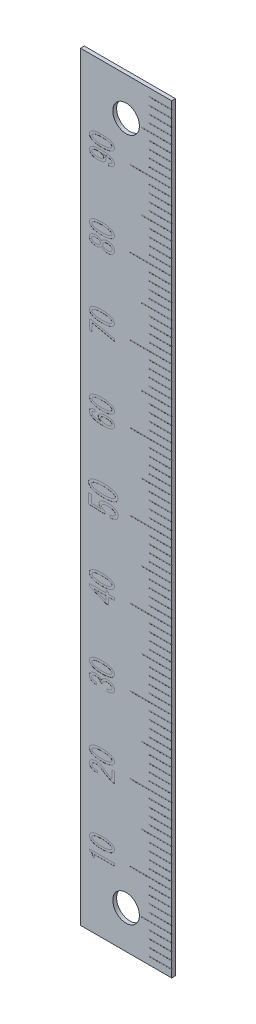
SolidWorks part; units mm, degrees
ref_plane "Front" through (0, 0, 0) normal (0, 0, 1) x (1, 0, 0)
ref_plane "Top" through (0, 0, 0) normal (0, 1, 0) x (1, 0, 0)
ref_plane "Right" through (0, 0, 0) normal (1, 0, 0) x (0, 0, -1)
sketch "Sketch1" plane through (0, 0, 0) normal (0, 0, 1) x (1, 0, 0)
  line L1 (0, 0) -> (0, 100)
  line L2 (0, 0) -> (12, 0)
  line L3 (12, 0) -> (12, 100)
  line L4 (0, 100) -> (12, 100)
  dimension "D1" = 100
  dimension "D2" = 12
extrude "Extrude1" add sketch "Sketch1" along normal blind 0.5
sketch "Sketch2" plane through (0, 0, 0.5) normal (0, 0, 1) x (1, 0, 0)
  line L0 (0, 100) -> (0, 0) construction
  line L1 (0, 0) -> (12, 0) construction
  line L2 (12, 100) -> (0, 100) construction
  circle A0 centre (6, 5) radius 1.75
  circle A1 centre (6, 95) radius 1.75
  dimension "D1" = 6
  dimension "D2" = 6
  dimension "D3" = 5
  dimension "D4" = 5
  dimension "D5" = 3.5
  dimension "D6" = 3.5
extrude "Extrude2" cut sketch "Sketch2" against normal through all
sketch "Sketch3" plane through (0, 0, 0.5) normal (0, 0, 1) x (1, 0, 0)
  line L0 (12, 100) -> (0, 100) construction
  line L1 (1, 88.25) -> (4.5, 88.25) construction
  line L2 (1, 88.25) -> (1, 91.75) construction
  line L3 (1, 91.75) -> (4.5, 91.75) construction
  line L4 (4.5, 88.25) -> (4.5, 91.75) construction
  line L5 (0, 100) -> (0, 0) construction
  line L6 (4.5, 78.25) -> (4.5, 81.75) construction
  line L7 (4.5, 68.25) -> (4.5, 71.75) construction
  line L8 (4.5, 58.25) -> (4.5, 61.75) construction
  line L9 (5, 48.25) -> (5, 51.75) construction
  line L10 (4.5, 38.25) -> (4.5, 41.75) construction
  line L11 (4.5, 28.25) -> (4.5, 31.75) construction
  line L12 (4.5, 18.25) -> (4.5, 21.75) construction
  line L13 (4.5, 8.25) -> (4.5, 11.75) construction
  line L14 (12, 0) -> (12, 100) construction
  text T0 "90" font "ＭＳ ゴシック" height in points 11
  text T1 "80  " font "ＭＳ ゴシック" height in points 11
  text T2 "70" font "ＭＳ ゴシック" height in points 11
  text T3 "60" font "ＭＳ ゴシック" height in points 11
  text T4 "50" font "ＭＳ ゴシック" height in points 13
  text T5 "40  " font "ＭＳ ゴシック" height in points 11
  text T6 "30" font "ＭＳ ゴシック" height in points 11
  text T7 "20" font "ＭＳ ゴシック" height in points 11
  text T8 "10" font "ＭＳ ゴシック" height in points 11
  point P4 (4.5, 90)
  dimension "D1" = 3.5
  dimension "D2" = 10
  dimension "D3" = 1
  dimension "D4" = 3.5
  dimension "D6" = 7
  dimension "D5" = 4
extrude "Extrude3" cut sketch "Sketch3" against normal blind 0.01
sketch "Sketch4" plane through (0, 0, 0.5) normal (0, 0, 1) x (1, 0, 0)
  line L0 (12, 90.05) -> (6.5, 90.05)
  line L1 (12, 0) -> (12, 100) construction
  line L2 (6.5, 90.05) -> (6.5, 89.95)
  line L3 (6.5, 89.95) -> (12, 89.95)
  line L4 (12, 89.95) -> (12, 90.05)
  line L5 (12, 100) -> (0, 100) construction
  line L6 (12, 98.05) -> (12, 97.95)
  line L7 (12, 94.95) -> (8, 94.95)
  line L8 (12, 94.95) -> (12, 95.05)
  line L9 (12, 95.05) -> (8, 95.05)
  line L10 (8, 94.95) -> (8, 95.05)
  line L11 (12, 99.05) -> (9, 99.05)
  line L12 (12, 99.05) -> (12, 98.95)
  line L13 (12, 98.95) -> (9, 98.95)
  line L14 (9, 99.05) -> (9, 98.95)
  line L15 (12, 98.05) -> (9, 98.05)
  line L16 (12, 97.95) -> (9, 97.95)
  line L17 (9, 98.05) -> (9, 97.95)
  line L18 (12, 97.05) -> (12, 96.95)
  line L19 (12, 97.05) -> (9, 97.05)
  line L20 (12, 96.95) -> (9, 96.95)
  line L21 (9, 97.05) -> (9, 96.95)
  line L22 (12, 96.05) -> (12, 95.95)
  line L23 (12, 96.05) -> (9, 96.05)
  line L24 (12, 95.95) -> (9, 95.95)
  line L25 (9, 96.05) -> (9, 95.95)
  line L26 (12, 80.05) -> (6.5, 80.05)
  line L27 (6.5, 80.05) -> (6.5, 79.95)
  line L28 (6.5, 79.95) -> (12, 79.95)
  line L29 (12, 79.95) -> (12, 80.05)
  line L30 (12, 94.05) -> (12, 93.95)
  line L31 (12, 94.05) -> (9, 94.05)
  line L32 (12, 93.95) -> (9, 93.95)
  line L33 (9, 94.05) -> (9, 93.95)
  line L34 (12, 93.05) -> (12, 92.95)
  line L35 (12, 93.05) -> (9, 93.05)
  line L36 (12, 92.95) -> (9, 92.95)
  line L37 (9, 93.05) -> (9, 92.95)
  line L38 (12, 92.05) -> (12, 91.95)
  line L39 (12, 92.05) -> (9, 92.05)
  line L40 (12, 91.95) -> (9, 91.95)
  line L41 (9, 92.05) -> (9, 91.95)
  line L42 (12, 91.05) -> (12, 90.95)
  line L43 (12, 91.05) -> (9, 91.05)
  line L44 (12, 90.95) -> (9, 90.95)
  line L45 (9, 91.05) -> (9, 90.95)
  line L46 (9, 95.05) -> (9, 94.95)
  line L47 (12, 95.05) -> (9, 95.05)
  line L48 (12, 94.95) -> (9, 94.95)
  line L49 (12, 95.05) -> (12, 94.95)
  line L50 (12, 88.05) -> (12, 87.95)
  line L51 (12, 84.95) -> (8, 84.95)
  line L52 (12, 84.95) -> (12, 85.05)
  line L53 (12, 85.05) -> (8, 85.05)
  line L54 (8, 84.95) -> (8, 85.05)
  line L55 (12, 89.05) -> (9, 89.05)
  line L56 (12, 89.05) -> (12, 88.95)
  line L57 (12, 88.95) -> (9, 88.95)
  line L58 (9, 89.05) -> (9, 88.95)
  line L59 (12, 88.05) -> (9, 88.05)
  line L60 (12, 87.95) -> (9, 87.95)
  line L61 (9, 88.05) -> (9, 87.95)
  line L62 (12, 87.05) -> (12, 86.95)
  line L63 (12, 87.05) -> (9, 87.05)
  line L64 (12, 86.95) -> (9, 86.95)
  line L65 (9, 87.05) -> (9, 86.95)
  line L66 (12, 86.05) -> (12, 85.95)
  line L67 (12, 86.05) -> (9, 86.05)
  line L68 (12, 85.95) -> (9, 85.95)
  line L69 (9, 86.05) -> (9, 85.95)
  line L70 (12, 84.05) -> (12, 83.95)
  line L71 (12, 84.05) -> (9, 84.05)
  line L72 (12, 83.95) -> (9, 83.95)
  line L73 (9, 84.05) -> (9, 83.95)
  line L74 (12, 83.05) -> (12, 82.95)
  line L75 (12, 83.05) -> (9, 83.05)
  line L76 (12, 82.95) -> (9, 82.95)
  line L77 (9, 83.05) -> (9, 82.95)
  line L78 (12, 82.05) -> (12, 81.95)
  line L79 (12, 82.05) -> (9, 82.05)
  line L80 (12, 81.95) -> (9, 81.95)
  line L81 (9, 82.05) -> (9, 81.95)
  line L82 (12, 81.05) -> (12, 80.95)
  line L83 (12, 81.05) -> (9, 81.05)
  line L84 (12, 80.95) -> (9, 80.95)
  line L85 (9, 81.05) -> (9, 80.95)
  line L86 (12, 70.05) -> (6.5, 70.05)
  line L87 (6.5, 70.05) -> (6.5, 69.95)
  line L88 (6.5, 69.95) -> (12, 69.95)
  line L89 (12, 69.95) -> (12, 70.05)
  line L90 (12, 78.05) -> (12, 77.95)
  line L91 (12, 74.95) -> (8, 74.95)
  line L92 (12, 74.95) -> (12, 75.05)
  line L93 (12, 75.05) -> (8, 75.05)
  line L94 (8, 74.95) -> (8, 75.05)
  line L95 (12, 79.05) -> (9, 79.05)
  line L96 (12, 79.05) -> (12, 78.95)
  line L97 (12, 78.95) -> (9, 78.95)
  line L98 (9, 79.05) -> (9, 78.95)
  line L99 (12, 78.05) -> (9, 78.05)
  line L100 (12, 77.95) -> (9, 77.95)
  line L101 (9, 78.05) -> (9, 77.95)
  line L102 (12, 77.05) -> (12, 76.95)
  line L103 (12, 77.05) -> (9, 77.05)
  line L104 (12, 76.95) -> (9, 76.95)
  line L105 (9, 77.05) -> (9, 76.95)
  line L106 (12, 76.05) -> (12, 75.95)
  line L107 (12, 76.05) -> (9, 76.05)
  line L108 (12, 75.95) -> (9, 75.95)
  line L109 (9, 76.05) -> (9, 75.95)
  line L110 (12, 74.05) -> (12, 73.95)
  line L111 (12, 74.05) -> (9, 74.05)
  line L112 (12, 73.95) -> (9, 73.95)
  line L113 (9, 74.05) -> (9, 73.95)
  line L114 (12, 73.05) -> (12, 72.95)
  line L115 (12, 73.05) -> (9, 73.05)
  line L116 (12, 72.95) -> (9, 72.95)
  line L117 (9, 73.05) -> (9, 72.95)
  line L118 (12, 72.05) -> (12, 71.95)
  line L119 (12, 72.05) -> (9, 72.05)
  line L120 (12, 71.95) -> (9, 71.95)
  line L121 (9, 72.05) -> (9, 71.95)
  line L122 (12, 71.05) -> (12, 70.95)
  line L123 (12, 71.05) -> (9, 71.05)
  line L124 (12, 70.95) -> (9, 70.95)
  line L125 (9, 71.05) -> (9, 70.95)
  line L126 (12, 60.05) -> (6.5, 60.05)
  line L127 (6.5, 60.05) -> (6.5, 59.95)
  line L128 (6.5, 59.95) -> (12, 59.95)
  line L129 (12, 59.95) -> (12, 60.05)
  line L130 (12, 68.05) -> (12, 67.95)
  line L131 (12, 64.95) -> (8, 64.95)
  line L132 (12, 64.95) -> (12, 65.05)
  line L133 (12, 65.05) -> (8, 65.05)
  line L134 (8, 64.95) -> (8, 65.05)
  line L135 (12, 69.05) -> (9, 69.05)
  line L136 (12, 69.05) -> (12, 68.95)
  line L137 (12, 68.95) -> (9, 68.95)
  line L138 (9, 69.05) -> (9, 68.95)
  line L139 (12, 68.05) -> (9, 68.05)
  line L140 (12, 67.95) -> (9, 67.95)
  line L141 (9, 68.05) -> (9, 67.95)
  line L142 (12, 67.05) -> (12, 66.95)
  line L143 (12, 67.05) -> (9, 67.05)
  line L144 (12, 66.95) -> (9, 66.95)
  line L145 (9, 67.05) -> (9, 66.95)
  line L146 (12, 66.05) -> (12, 65.95)
  line L147 (12, 66.05) -> (9, 66.05)
  line L148 (12, 65.95) -> (9, 65.95)
  line L149 (9, 66.05) -> (9, 65.95)
  line L150 (12, 64.05) -> (12, 63.95)
  line L151 (12, 64.05) -> (9, 64.05)
  line L152 (12, 63.95) -> (9, 63.95)
  line L153 (9, 64.05) -> (9, 63.95)
  line L154 (12, 63.05) -> (12, 62.95)
  line L155 (12, 63.05) -> (9, 63.05)
  line L156 (12, 62.95) -> (9, 62.95)
  line L157 (9, 63.05) -> (9, 62.95)
  line L158 (12, 62.05) -> (12, 61.95)
  line L159 (12, 62.05) -> (9, 62.05)
  line L160 (12, 61.95) -> (9, 61.95)
  line L161 (9, 62.05) -> (9, 61.95)
  line L162 (12, 61.05) -> (12, 60.95)
  line L163 (12, 61.05) -> (9, 61.05)
  line L164 (12, 60.95) -> (9, 60.95)
  line L165 (9, 61.05) -> (9, 60.95)
  line L166 (12, 50.05) -> (6.5, 50.05)
  line L167 (6.5, 50.05) -> (6.5, 49.95)
  line L168 (6.5, 49.95) -> (12, 49.95)
  line L169 (12, 49.95) -> (12, 50.05)
  line L170 (12, 58.05) -> (12, 57.95)
  line L171 (12, 54.95) -> (8, 54.95)
  line L172 (12, 54.95) -> (12, 55.05)
  line L173 (12, 55.05) -> (8, 55.05)
  line L174 (8, 54.95) -> (8, 55.05)
  line L175 (12, 59.05) -> (9, 59.05)
  line L176 (12, 59.05) -> (12, 58.95)
  line L177 (12, 58.95) -> (9, 58.95)
  line L178 (9, 59.05) -> (9, 58.95)
  line L179 (12, 58.05) -> (9, 58.05)
  line L180 (12, 57.95) -> (9, 57.95)
  line L181 (9, 58.05) -> (9, 57.95)
  line L182 (12, 57.05) -> (12, 56.95)
  line L183 (12, 57.05) -> (9, 57.05)
  line L184 (12, 56.95) -> (9, 56.95)
  line L185 (9, 57.05) -> (9, 56.95)
  line L186 (12, 56.05) -> (12, 55.95)
  line L187 (12, 56.05) -> (9, 56.05)
  line L188 (12, 55.95) -> (9, 55.95)
  line L189 (9, 56.05) -> (9, 55.95)
  line L190 (12, 54.05) -> (12, 53.95)
  line L191 (12, 54.05) -> (9, 54.05)
  line L192 (12, 53.95) -> (9, 53.95)
  line L193 (9, 54.05) -> (9, 53.95)
  line L194 (12, 53.05) -> (12, 52.95)
  line L195 (12, 53.05) -> (9, 53.05)
  line L196 (12, 52.95) -> (9, 52.95)
  line L197 (9, 53.05) -> (9, 52.95)
  line L198 (12, 52.05) -> (12, 51.95)
  line L199 (12, 52.05) -> (9, 52.05)
  line L200 (12, 51.95) -> (9, 51.95)
  line L201 (9, 52.05) -> (9, 51.95)
  line L202 (12, 51.05) -> (12, 50.95)
  line L203 (12, 51.05) -> (9, 51.05)
  line L204 (12, 50.95) -> (9, 50.95)
  line L205 (9, 51.05) -> (9, 50.95)
  line L206 (12, 50.05) -> (6.5, 50.05)
  line L207 (6.5, 50.05) -> (6.5, 49.95)
  line L208 (6.5, 49.95) -> (12, 49.95)
  line L209 (12, 49.95) -> (12, 50.05)
  line L210 (12, 48.05) -> (12, 47.95)
  line L211 (12, 44.95) -> (8, 44.95)
  line L212 (12, 44.95) -> (12, 45.05)
  line L213 (12, 45.05) -> (8, 45.05)
  line L214 (8, 44.95) -> (8, 45.05)
  line L215 (12, 49.05) -> (9, 49.05)
  line L216 (12, 49.05) -> (12, 48.95)
  line L217 (12, 48.95) -> (9, 48.95)
  line L218 (9, 49.05) -> (9, 48.95)
  line L219 (12, 48.05) -> (9, 48.05)
  line L220 (12, 47.95) -> (9, 47.95)
  line L221 (9, 48.05) -> (9, 47.95)
  line L222 (12, 47.05) -> (12, 46.95)
  line L223 (12, 47.05) -> (9, 47.05)
  line L224 (12, 46.95) -> (9, 46.95)
  line L225 (9, 47.05) -> (9, 46.95)
  line L226 (12, 46.05) -> (12, 45.95)
  line L227 (12, 46.05) -> (9, 46.05)
  line L228 (12, 45.95) -> (9, 45.95)
  line L229 (9, 46.05) -> (9, 45.95)
  line L230 (12, 44.05) -> (12, 43.95)
  line L231 (12, 44.05) -> (9, 44.05)
  line L232 (12, 43.95) -> (9, 43.95)
  line L233 (9, 44.05) -> (9, 43.95)
  line L234 (12, 43.05) -> (12, 42.95)
  line L235 (12, 43.05) -> (9, 43.05)
  line L236 (12, 42.95) -> (9, 42.95)
  line L237 (9, 43.05) -> (9, 42.95)
  line L238 (12, 42.05) -> (12, 41.95)
  line L239 (12, 42.05) -> (9, 42.05)
  line L240 (12, 41.95) -> (9, 41.95)
  line L241 (9, 42.05) -> (9, 41.95)
  line L242 (12, 41.05) -> (12, 40.95)
  line L243 (12, 41.05) -> (9, 41.05)
  line L244 (12, 40.95) -> (9, 40.95)
  line L245 (9, 41.05) -> (9, 40.95)
  line L246 (12, 40.05) -> (6.5, 40.05)
  line L247 (6.5, 40.05) -> (6.5, 39.95)
  line L248 (6.5, 39.95) -> (12, 39.95)
  line L249 (12, 39.95) -> (12, 40.05)
  line L250 (12, 38.05) -> (12, 37.95)
  line L251 (12, 34.95) -> (8, 34.95)
  line L252 (12, 34.95) -> (12, 35.05)
  line L253 (12, 35.05) -> (8, 35.05)
  line L254 (8, 34.95) -> (8, 35.05)
  line L255 (12, 39.05) -> (9, 39.05)
  line L256 (12, 39.05) -> (12, 38.95)
  line L257 (12, 38.95) -> (9, 38.95)
  line L258 (9, 39.05) -> (9, 38.95)
  line L259 (12, 38.05) -> (9, 38.05)
  line L260 (12, 37.95) -> (9, 37.95)
  line L261 (9, 38.05) -> (9, 37.95)
  line L262 (12, 37.05) -> (12, 36.95)
  line L263 (12, 37.05) -> (9, 37.05)
  line L264 (12, 36.95) -> (9, 36.95)
  line L265 (9, 37.05) -> (9, 36.95)
  line L266 (12, 36.05) -> (12, 35.95)
  line L267 (12, 36.05) -> (9, 36.05)
  line L268 (12, 35.95) -> (9, 35.95)
  line L269 (9, 36.05) -> (9, 35.95)
  line L270 (12, 34.05) -> (12, 33.95)
  line L271 (12, 34.05) -> (9, 34.05)
  line L272 (12, 33.95) -> (9, 33.95)
  line L273 (9, 34.05) -> (9, 33.95)
  line L274 (12, 33.05) -> (12, 32.95)
  line L275 (12, 33.05) -> (9, 33.05)
  line L276 (12, 32.95) -> (9, 32.95)
  line L277 (9, 33.05) -> (9, 32.95)
  line L278 (12, 32.05) -> (12, 31.95)
  line L279 (12, 32.05) -> (9, 32.05)
  line L280 (12, 31.95) -> (9, 31.95)
  line L281 (9, 32.05) -> (9, 31.95)
  line L282 (12, 31.05) -> (12, 30.95)
  line L283 (12, 31.05) -> (9, 31.05)
  line L284 (12, 30.95) -> (9, 30.95)
  line L285 (9, 31.05) -> (9, 30.95)
  line L286 (12, 30.05) -> (6.5, 30.05)
  line L287 (6.5, 30.05) -> (6.5, 29.95)
  line L288 (6.5, 29.95) -> (12, 29.95)
  line L289 (12, 29.95) -> (12, 30.05)
  line L290 (12, 28.05) -> (12, 27.95)
  line L291 (12, 24.95) -> (8, 24.95)
  line L292 (12, 24.95) -> (12, 25.05)
  line L293 (12, 25.05) -> (8, 25.05)
  line L294 (8, 24.95) -> (8, 25.05)
  line L295 (12, 29.05) -> (9, 29.05)
  line L296 (12, 29.05) -> (12, 28.95)
  line L297 (12, 28.95) -> (9, 28.95)
  line L298 (9, 29.05) -> (9, 28.95)
  line L299 (12, 28.05) -> (9, 28.05)
  line L300 (12, 27.95) -> (9, 27.95)
  line L301 (9, 28.05) -> (9, 27.95)
  line L302 (12, 27.05) -> (12, 26.95)
  line L303 (12, 27.05) -> (9, 27.05)
  line L304 (12, 26.95) -> (9, 26.95)
  line L305 (9, 27.05) -> (9, 26.95)
  line L306 (12, 26.05) -> (12, 25.95)
  line L307 (12, 26.05) -> (9, 26.05)
  line L308 (12, 25.95) -> (9, 25.95)
  line L309 (9, 26.05) -> (9, 25.95)
  line L310 (12, 24.05) -> (12, 23.95)
  line L311 (12, 24.05) -> (9, 24.05)
  line L312 (12, 23.95) -> (9, 23.95)
  line L313 (9, 24.05) -> (9, 23.95)
  line L314 (12, 23.05) -> (12, 22.95)
  line L315 (12, 23.05) -> (9, 23.05)
  line L316 (12, 22.95) -> (9, 22.95)
  line L317 (9, 23.05) -> (9, 22.95)
  line L318 (12, 22.05) -> (12, 21.95)
  line L319 (12, 22.05) -> (9, 22.05)
  line L320 (12, 21.95) -> (9, 21.95)
  line L321 (9, 22.05) -> (9, 21.95)
  line L322 (12, 21.05) -> (12, 20.95)
  line L323 (12, 21.05) -> (9, 21.05)
  line L324 (12, 20.95) -> (9, 20.95)
  line L325 (9, 21.05) -> (9, 20.95)
  line L326 (12, 20.05) -> (6.5, 20.05)
  line L327 (6.5, 20.05) -> (6.5, 19.95)
  line L328 (6.5, 19.95) -> (12, 19.95)
  line L329 (12, 19.95) -> (12, 20.05)
  line L330 (12, 18.05) -> (12, 17.95)
  line L331 (12, 14.95) -> (8, 14.95)
  line L332 (12, 14.95) -> (12, 15.05)
  line L333 (12, 15.05) -> (8, 15.05)
  line L334 (8, 14.95) -> (8, 15.05)
  line L335 (12, 19.05) -> (9, 19.05)
  line L336 (12, 19.05) -> (12, 18.95)
  line L337 (12, 18.95) -> (9, 18.95)
  line L338 (9, 19.05) -> (9, 18.95)
  line L339 (12, 18.05) -> (9, 18.05)
  line L340 (12, 17.95) -> (9, 17.95)
  line L341 (9, 18.05) -> (9, 17.95)
  line L342 (12, 17.05) -> (12, 16.95)
  line L343 (12, 17.05) -> (9, 17.05)
  line L344 (12, 16.95) -> (9, 16.95)
  line L345 (9, 17.05) -> (9, 16.95)
  line L346 (12, 16.05) -> (12, 15.95)
  line L347 (12, 16.05) -> (9, 16.05)
  line L348 (12, 15.95) -> (9, 15.95)
  line L349 (9, 16.05) -> (9, 15.95)
  line L350 (12, 14.05) -> (12, 13.95)
  line L351 (12, 14.05) -> (9, 14.05)
  line L352 (12, 13.95) -> (9, 13.95)
  line L353 (9, 14.05) -> (9, 13.95)
  line L354 (12, 13.05) -> (12, 12.95)
  line L355 (12, 13.05) -> (9, 13.05)
  line L356 (12, 12.95) -> (9, 12.95)
  line L357 (9, 13.05) -> (9, 12.95)
  line L358 (12, 12.05) -> (12, 11.95)
  line L359 (12, 12.05) -> (9, 12.05)
  line L360 (12, 11.95) -> (9, 11.95)
  line L361 (9, 12.05) -> (9, 11.95)
  line L362 (12, 11.05) -> (12, 10.95)
  line L363 (12, 11.05) -> (9, 11.05)
  line L364 (12, 10.95) -> (9, 10.95)
  line L365 (9, 11.05) -> (9, 10.95)
  line L366 (12, 10.05) -> (6.5, 10.05)
  line L367 (6.5, 10.05) -> (6.5, 9.95)
  line L368 (6.5, 9.95) -> (12, 9.95)
  line L369 (12, 9.95) -> (12, 10.05)
  line L370 (12, 8.05) -> (12, 7.95)
  line L371 (12, 4.95) -> (8, 4.95)
  line L372 (12, 4.95) -> (12, 5.05)
  line L373 (12, 5.05) -> (8, 5.05)
  line L374 (8, 4.95) -> (8, 5.05)
  line L375 (12, 9.05) -> (9, 9.05)
  line L376 (12, 9.05) -> (12, 8.95)
  line L377 (12, 8.95) -> (9, 8.95)
  line L378 (9, 9.05) -> (9, 8.95)
  line L379 (12, 8.05) -> (9, 8.05)
  line L380 (12, 7.95) -> (9, 7.95)
  line L381 (9, 8.05) -> (9, 7.95)
  line L382 (12, 7.05) -> (12, 6.95)
  line L383 (12, 7.05) -> (9, 7.05)
  line L384 (12, 6.95) -> (9, 6.95)
  line L385 (9, 7.05) -> (9, 6.95)
  line L386 (12, 6.05) -> (12, 5.95)
  line L387 (12, 6.05) -> (9, 6.05)
  line L388 (12, 5.95) -> (9, 5.95)
  line L389 (9, 6.05) -> (9, 5.95)
  line L390 (12, 4.05) -> (12, 3.95)
  line L391 (12, 4.05) -> (9, 4.05)
  line L392 (12, 3.95) -> (9, 3.95)
  line L393 (9, 4.05) -> (9, 3.95)
  line L394 (12, 3.05) -> (12, 2.95)
  line L395 (12, 3.05) -> (9, 3.05)
  line L396 (12, 2.95) -> (9, 2.95)
  line L397 (9, 3.05) -> (9, 2.95)
  line L398 (12, 2.05) -> (12, 1.95)
  line L399 (12, 2.05) -> (9, 2.05)
  line L400 (12, 1.95) -> (9, 1.95)
  line L401 (9, 2.05) -> (9, 1.95)
  line L402 (12, 1.05) -> (12, 0.95)
  line L403 (12, 1.05) -> (9, 1.05)
  line L404 (12, 0.95) -> (9, 0.95)
  line L405 (9, 1.05) -> (9, 0.95)
  point P4 (12, 90)
  point P13 (12, 95)
  point P18 (12, 99)
  dimension "D1" = 10
  dimension "D2" = 0.1
  dimension "D3" = 5.5
  dimension "D4" = 5
  dimension "D5" = 0.1
  dimension "D6" = 1
  dimension "D7" = 0.1
  dimension "D8" = 3
  dimension "D9" = 4
  dimension "D10" = 9
  dimension "D11" = 5
  dimension "D12" = 6
extrude "Extrude4" cut sketch "Sketch4" against normal blind 0.01
move or copy body "Body-Move/Copy2" bodies to move or copy 105 copy no translate (-12, -50, 0)
move or copy body "Body-Move/Copy3" bodies to move or copy 107 copy no translate (0, 50, 0)
